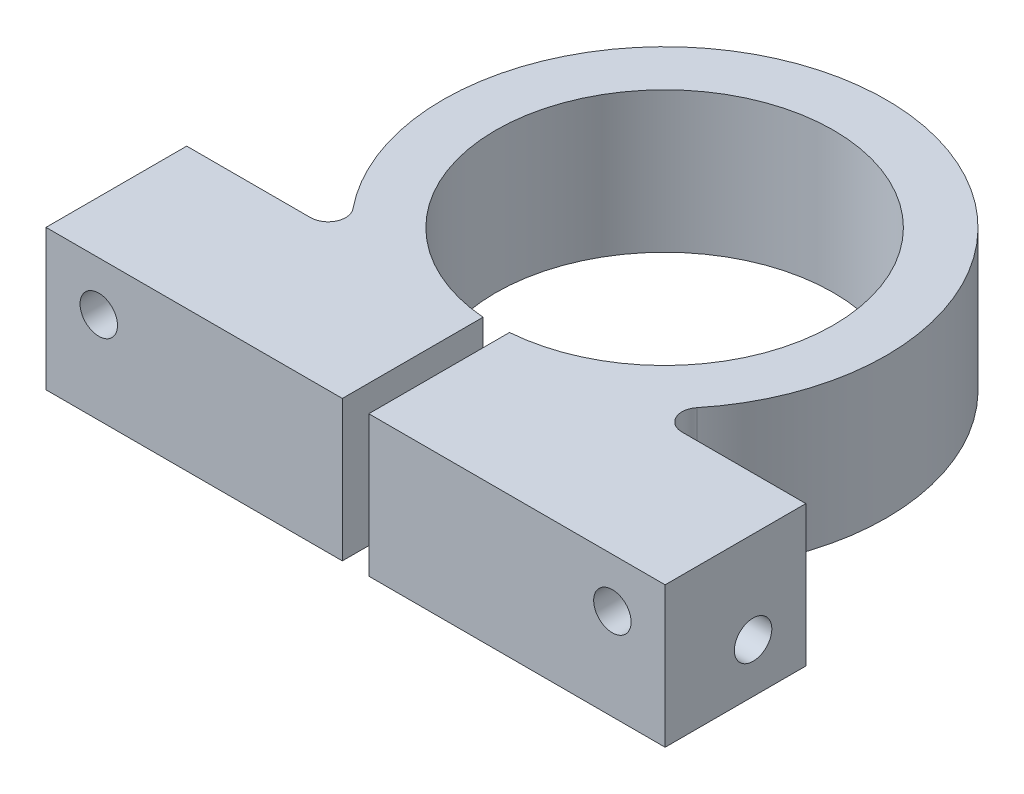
SolidWorks part; units mm, degrees
ref_plane "Front Plane" through (0, 0, 0) normal (0, 0, 1) x (1, 0, 0)
ref_plane "Top Plane" through (0, 0, 0) normal (0, 1, 0) x (1, 0, 0)
ref_plane "Right Plane" through (0, 0, 0) normal (1, 0, 0) x (0, 0, -1)
sketch "Sketch1" plane through (0, 0, 0) normal (0, 1, 0) x (1, 0, 0)
  line L0 (2.3876, -55.7863) -> (55.88, -55.7863)
  line L1 (-55.88, -30.3863) -> (-33.5269, -30.3863)
  line L2 (-55.88, -30.3863) -> (-55.88, -55.7863)
  line L3 (-55.88, -55.7863) -> (-2.3876, -55.7863)
  line L4 (55.88, -30.3863) -> (55.88, -55.7863)
  line L5 (33.5269, -30.3863) -> (55.88, -30.3863)
  line L6 (-40.005, 0) -> (40.005, 0) construction
  line L8 (-2.3876, -55.7863) -> (-2.3876, -30.3863)
  line L10 (2.3876, -55.7863) -> (2.3876, -30.3863)
  arc A0 (2.3876, -30.3863) -> (-2.3876, -30.3863) centre (0, 0) ccw
  arc A1 (31.0617, -25.2105) -> (-31.0617, -25.2105) centre (0, 0) ccw
  arc A2 (-33.5269, -30.3863) -> (-31.0617, -25.2105) centre (-33.5269, -27.2113) ccw
  arc A3 (31.0617, -25.2105) -> (33.5269, -30.3863) centre (33.5269, -27.2113) ccw
  dimension "D3" = 9.525
  dimension "D4" = 30.48
  dimension "D8" = 3.175
  dimension "D1" = 15.875
  dimension "D5" = 25.4
  dimension "D6" = 4.7752
  dimension "D7" = 2.3876
  dimension "D9" = 15.875
extrude "Extrude1" add sketch "Sketch1" along normal blind 25.4
hole_wizard "1/4 Clearance Hole2" positions "3DSketch1" profile "Sketch2" hole size "1/4" standard "Ansi Inch"
sketch3d "3DSketch1"
  line L0 (-55.88, 0, 30.3863) -> (-55.88, 0, 55.7863) construction
  line L1 (-55.88, 25.4, 30.3863) -> (-55.88, 0, 30.3863) construction
  point P0 (-55.88, 8.89, 39.9113)
  dimension "D1" = 8.89
  dimension "D2" = 9.525
sketch "Sketch2" plane through (-55.88, 8.89, 39.9113) normal (0, 1, 0) x (0, 0, 1)
  line L0 (0, 0) -> (0, 111.76)
  line L1 (0, 111.76) -> (3.3782, 111.76)
  line L2 (3.3782, 111.76) -> (3.3782, 0)
  line L5 (3.3782, 0) -> (0, 0)
  line L11 (0, -6.35) -> (0, 107.95) construction
  dimension "Thru Hole Dia." = 6.7564
  dimension "Thru Hole Depth" = 111.76
hole_wizard "1/4 Clearance Hole1" positions "3DSketch2" profile "Sketch3" hole size "1/4" standard "Ansi Inch"
sketch3d "3DSketch2"
  line L0 (-55.88, 25.4, 30.3863) -> (-55.88, 0, 30.3863) construction
  line L1 (-33.5269, 25.4, 30.3863) -> (-55.88, 25.4, 30.3863) construction
  point P0 (-46.355, 16.51, 30.3863)
  dimension "D1" = 9.525
  dimension "D2" = 8.89
sketch "Sketch3" plane through (-46.355, 16.51, 30.3863) normal (1, 0, 0) x (0, 1, 0)
  line L0 (0, 0) -> (0, 25.4)
  line L1 (0, 25.4) -> (3.3782, 25.4)
  line L2 (3.3782, 25.4) -> (3.3782, 0)
  line L5 (3.3782, 0) -> (0, 0)
  line L11 (0, -6.35) -> (0, 107.95) construction
  dimension "Thru Hole Dia." = 6.7564
  dimension "Thru Hole Depth" = 25.4
hole_wizard "1/4 Clearance Hole3" positions "3DSketch3" profile "Sketch4" hole size "1/4" standard "Ansi Inch"
sketch3d "3DSketch3"
  line L0 (55.88, 25.4, 30.3863) -> (55.88, 0, 30.3863) construction
  line L1 (55.88, 25.4, 30.3863) -> (33.5269, 25.4, 30.3863) construction
  point P0 (46.355, 16.51, 30.3863)
  dimension "D1" = 9.525
  dimension "D2" = 8.89
sketch "Sketch4" plane through (46.355, 16.51, 30.3863) normal (1, 0, 0) x (0, 1, 0)
  line L0 (0, 0) -> (0, 25.4)
  line L1 (0, 25.4) -> (3.3782, 25.4)
  line L2 (3.3782, 25.4) -> (3.3782, 0)
  line L5 (3.3782, 0) -> (0, 0)
  line L11 (0, -6.35) -> (0, 107.95) construction
  dimension "Thru Hole Dia." = 6.7564
  dimension "Thru Hole Depth" = 25.4
